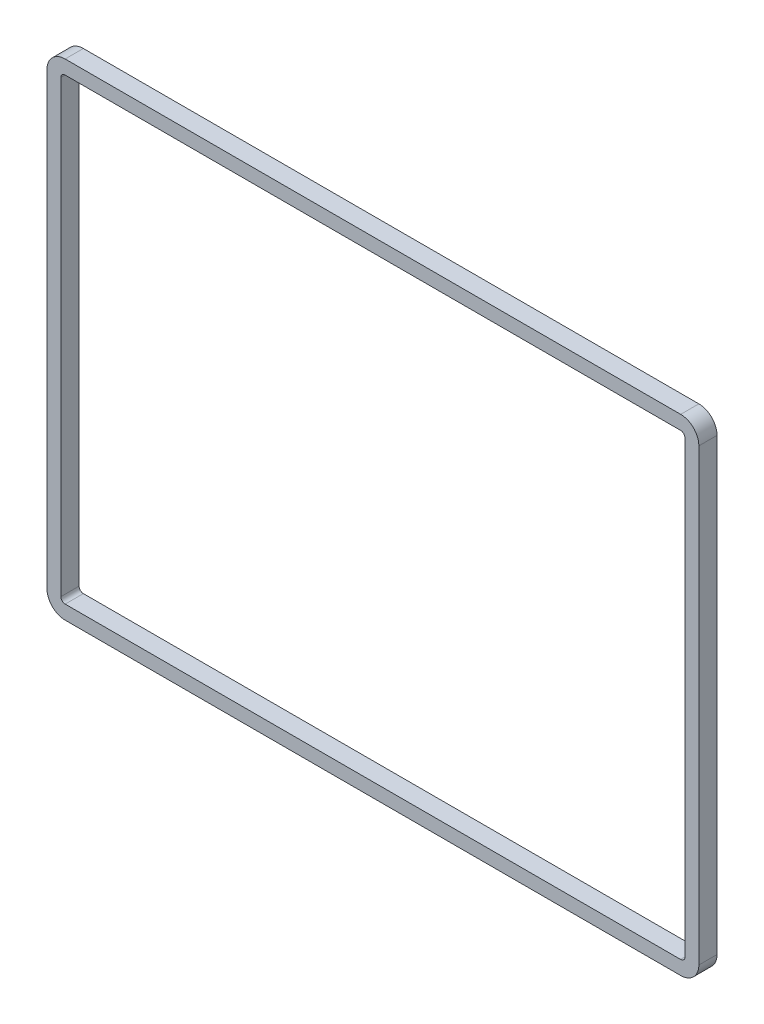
SolidWorks part; units mm, degrees
ref_plane "Plan de face" through (0, 0, 0) normal (0, 0, 1) x (1, 0, 0)
ref_plane "Plan de dessus" through (0, 0, 0) normal (0, 1, 0) x (1, 0, 0)
ref_plane "Plan de droite" through (0, 0, 0) normal (1, 0, 0) x (0, 0, -1)
sketch "Esquisse1" plane through (0, 0, 0) normal (0, 0, 1) x (1, 0, 0)
  line L1 (-54.0926, -30.8653) -> (3.4074, -30.8653)
  line L2 (-55.7926, -29.1653) -> (-55.7926, 12.8347)
  line L3 (-54.0926, 14.5347) -> (3.4074, 14.5347)
  line L4 (5.1074, -29.1653) -> (5.1074, 12.8347)
  line L5 (-54.0926, -29.5653) -> (3.4074, -29.5653)
  line L6 (-54.4926, -29.1653) -> (-54.4926, 12.8347)
  line L7 (-54.0926, 13.2347) -> (3.4074, 13.2347)
  line L8 (3.8074, -29.1653) -> (3.8074, 12.8347)
  arc A0 (-54.4926, 12.8347) -> (-54.0926, 13.2347) centre (-54.0926, 12.8347) cw
  arc A1 (-54.0926, -29.5653) -> (-54.4926, -29.1653) centre (-54.0926, -29.1653) cw
  arc A2 (3.4074, 13.2347) -> (3.8074, 12.8347) centre (3.4074, 12.8347) cw
  arc A3 (3.4074, -29.5653) -> (3.8074, -29.1653) centre (3.4074, -29.1653) ccw
  arc A4 (3.4074, 14.5347) -> (5.1074, 12.8347) centre (3.4074, 12.8347) cw
  arc A5 (3.4074, -30.8653) -> (5.1074, -29.1653) centre (3.4074, -29.1653) ccw
  arc A6 (-54.0926, -30.8653) -> (-55.7926, -29.1653) centre (-54.0926, -29.1653) cw
  arc A7 (-55.7926, 12.8347) -> (-54.0926, 14.5347) centre (-54.0926, 12.8347) cw
  point P10 (-54.4926, 13.2347)
  point P15 (3.8074, 13.2347)
  point P20 (5.1074, 14.5347)
  point P27 (-55.7926, 14.5347)
  dimension "D7" = 0.4
  dimension "D8" = 1.7
  dimension "D1" = 58.3
  dimension "D2" = 60.9
  dimension "D3" = 1.3
  dimension "D4" = 1.3
  dimension "D5" = 45.4
  dimension "D6" = 42.8
extrude "Extrusion1" add sketch "Esquisse1" along normal blind 1.7
